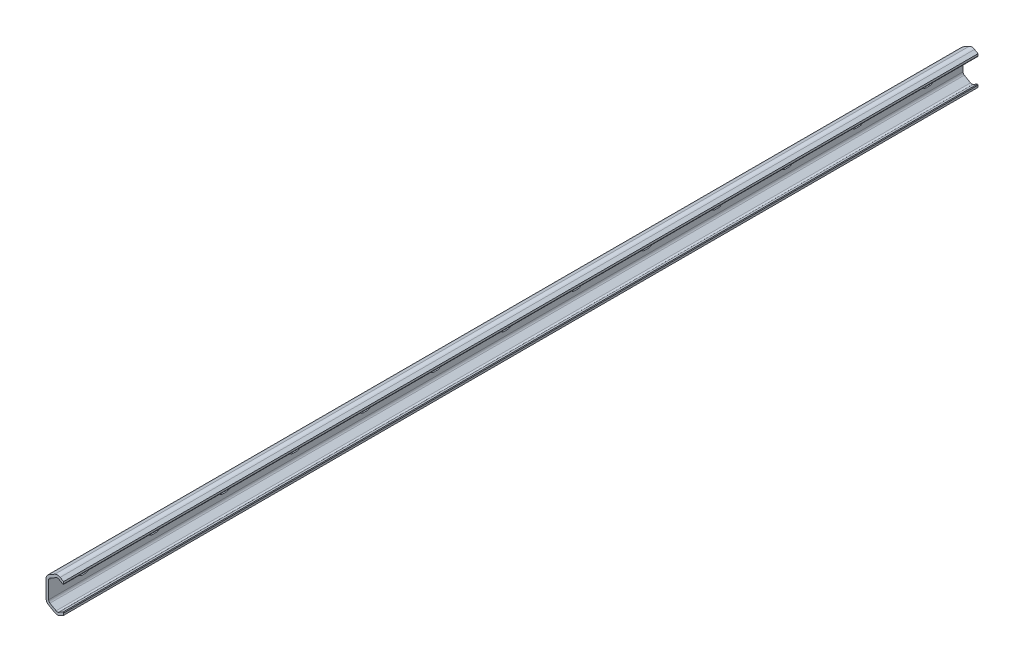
SolidWorks part; units mm, degrees
ref_plane "Front Plane" through (0, 0, 0) normal (0, 0, 1) x (1, 0, 0)
ref_plane "Top Plane" through (0, 0, 0) normal (0, 1, 0) x (1, 0, 0)
ref_plane "Right Plane" through (0, 0, 0) normal (1, 0, 0) x (0, 0, -1)
sketch "Sketch1" plane through (0, 0, 0) normal (0, 0, 1) x (1, 0, 0)
  line L0 (19.4996, 13.4748) -> (20, 14.3415)
  line L1 (20, 14.3415) -> (20, 16.65)
  line L2 (20, 16.65) -> (16.0762, 18.9154)
  line L3 (10, 18.9601) -> (3, 14.9186)
  line L4 (0, 9.7225) -> (0, 0)
  line L5 (0, 0) -> (0, -9.7225)
  line L6 (3, -14.9186) -> (10, -18.9601)
  line L7 (16.0762, -18.9154) -> (20, -16.65)
  line L8 (20, -16.65) -> (20, -14.3415)
  line L9 (20, -14.3415) -> (19.4996, -13.4748)
  line L10 (19.4996, -13.4748) -> (14.5538, -16.3303)
  line L11 (11.5, -16.3621) -> (4.5, -12.3206)
  line L12 (3, -9.7225) -> (3, 9.7225)
  line L13 (4.5, 12.3206) -> (11.5, 16.3621)
  line L14 (14.5538, 16.3303) -> (19.4996, 13.4748)
  arc A0 (16.0762, 18.9154) -> (10, 18.9601) centre (12.9987, 13.585) ccw
  arc A1 (3, 14.9186) -> (0, 9.7225) centre (6, 9.7225) ccw
  arc A2 (0, -9.7225) -> (3, -14.9186) centre (6, -9.7225) ccw
  arc A3 (10, -18.9601) -> (16.0762, -18.9154) centre (13, -13.764) ccw
  arc A4 (14.5538, -16.3303) -> (11.5, -16.3621) centre (12.9987, -13.6368) cw
  arc A5 (4.5, -12.3206) -> (3, -9.7225) centre (6, -9.7225) cw
  arc A6 (3, 9.7225) -> (4.5, 12.3206) centre (6, 9.7225) cw
  arc A7 (11.5, 16.3621) -> (14.5538, 16.3303) centre (13, 13.764) cw
  point P10 (20, -15.4957)
  dimension "D1" = 3
  dimension "D12" = 6.155
  dimension "D2" = 4.5
  dimension "D3" = 10
  dimension "D4" = 16.0762
  dimension "D5" = 9.7225
  dimension "D6" = 19.4996
  dimension "D7" = 20
  dimension "D8" = 13.4748
  dimension "D9" = 16.3621
  dimension "D10" = 16.3303
  dimension "D11" = 18.9154
  dimension "D13" = 20
extrude "Boss-Extrude1" add sketch "Sketch1" against normal blind 1040 contours L4 L5 A2 L6 A3 L7 L8 L9 L10 A4 L11 A5 L12 A6 L13 A7 L14 L0 L1 L2 A0 L3 A1
sketch "Sketch2" plane through (3, 0, 0) normal (1, 0, 0) x (0, 0, -1)
  line L0 (42, 0) -> (38, 0) construction
  line L1 (42, -4.5) -> (38, -4.5)
  line L2 (42, 4.5) -> (38, 4.5)
  arc A0 (42, -4.5) -> (42, 4.5) centre (42, 0) ccw
  arc A1 (38, 4.5) -> (38, -4.5) centre (38, 0) ccw
  point P2 (40, 0)
  point P8 (40, 4.5)
  dimension "D1" = 4
  dimension "D2" = 9
  dimension "D3" = 40
extrude "Cut-Extrude1" cut sketch "Sketch2" against normal through all
pattern_linear "LPattern1" count 13 spacing 80 along (0, 0, -1) of "Cut-Extrude1"
